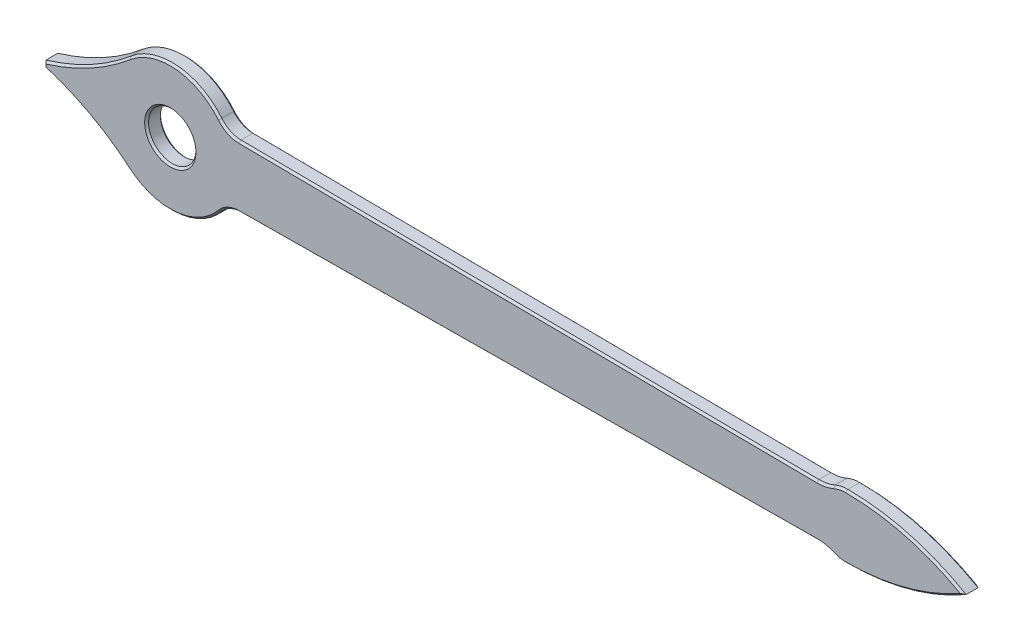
SolidWorks part; units mm, degrees
ref_plane "Спереди" through (0, 0, 0) normal (0, 0, 1) x (1, 0, 0)
ref_plane "Сверху" through (0, 0, 0) normal (0, 1, 0) x (1, 0, 0)
ref_plane "Справа" through (0, 0, 0) normal (1, 0, 0) x (0, 0, -1)
sketch "Эскиз1" plane through (0, 0, 0) normal (0, 0, 1) x (1, 0, 0)
  line L64 (81.9486, 3.3) -> (8.7197, 3.9391)
  line L65 (81.9486, -3.3) -> (8.7197, -3.9391)
  line L204 (-16, 0.3555) -> (-16, -0.3555)
  line L313 (-16, 0) -> (100.6, 0) construction
  line L314 (0, -8.1) -> (0, 0) construction
  circle A0 centre (0, 0) radius 3
  arc A1 (6.2842, 5.1107) -> (-5.2289, 6.1862) centre (0, 0) ccw
  arc A2 (-16, 0.3555) -> (-5.2289, 6.1862) centre (-24.5952, 29.0978) ccw
  arc A3 (6.2842, 5.1107) -> (8.7197, 3.9391) centre (8.7474, 7.1139) ccw
  arc A4 (-5.2289, -6.1862) -> (6.2842, -5.1107) centre (0, 0) ccw
  arc A5 (6.2842, -5.1107) -> (8.7197, -3.9391) centre (8.7474, -7.1139) cw
  arc A6 (-16, -0.3555) -> (-5.2289, -6.1862) centre (-24.5952, -29.0978) cw
  arc A7 (83.9855, -3.7143) -> (85.6, -4.05) centre (85.6, 0) ccw
  arc A8 (81.9486, 3.3) -> (83.9855, 3.7143) centre (81.9923, 8.2998) ccw
  arc A9 (81.9486, -3.3) -> (83.9855, -3.7143) centre (81.9923, -8.2998) cw
  arc A10 (100.6, 0) -> (85.6, 4.05) centre (85.6, -25.7528) ccw
  arc A11 (85.6, 4.05) -> (83.9855, 3.7143) centre (85.6, 0) ccw
  arc A12 (100.6, 0) -> (85.6, -4.05) centre (85.6, 25.7528) cw
  dimension "D1" = 6
  dimension "D2" = 16.2
  dimension "D5" = 60
  dimension "D9" = 6.35
  dimension "D11" = 4.05
  dimension "D7" = 10
  dimension "D3" = 0.3555
  dimension "D4" = 16
  dimension "D6" = 0.5
  dimension "D8" = 3.3
  dimension "D10" = 100.6
  dimension "D12" = 85.6
extrude "Бобышка-Вытянуть1" add sketch "Эскиз1" along normal blind 2
chamfer "Фаска1" distance 0.25 angle 45 32 edges at (3, 0, 0) (93.3686, 3.0197, 0) (84.7755, 3.9652, 0) (82.9888, 3.4001, 0) (45.3342, 3.6195, 0) (7.3711, 4.2528, 0) (0.7534, 8.0649, 0) (-10.3137, 2.7153, 0) (-16, 0, 0) (-10.3137, -2.7153, 0) (0.7534, -8.0649, 0) (7.3711, -4.2528, 0) (45.3342, -3.6195, 0) (82.9888, -3.4001, 0) (84.7755, -3.9652, 0) (93.3686, -3.0197, 0) (3, 0, 2) (84.7755, -3.9652, 2) (82.9888, -3.4001, 2) (45.3342, -3.6195, 2) (7.3711, -4.2528, 2) (0.7534, -8.0649, 2) (-10.3137, -2.7153, 2) (-16, 0, 2) (-10.3137, 2.7153, 2) (0.7534, 8.0649, 2) (7.3711, 4.2528, 2) (45.3342, 3.6195, 2) (82.9888, 3.4001, 2) (84.7755, 3.9652, 2) (93.3686, 3.0197, 2) (93.3686, -3.0197, 2)
